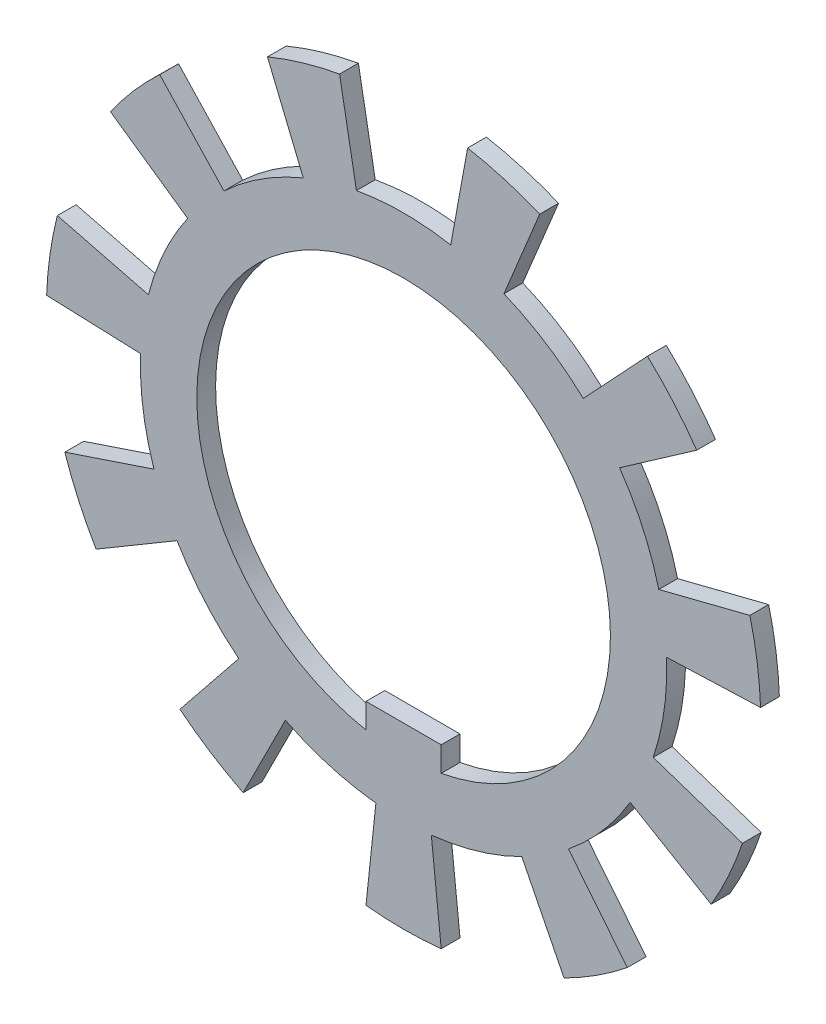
SolidWorks part; units mm, degrees
ref_plane "Front Plane" through (0, 0, 0) normal (0, 0, 1) x (1, 0, 0)
ref_plane "Top Plane" through (0, 0, 0) normal (0, 1, 0) x (1, 0, 0)
ref_plane "Right Plane" through (0, 0, 0) normal (1, 0, 0) x (0, 0, -1)
sketch "BodySke" plane through (0, 0, 0) normal (0, 1, 0) x (1, 0, 0)
  line L0 (0, 0) -> (0, 11) construction
  line L1 (0, 0) -> (4, 0) construction
  line L2 (11, 0) -> (19, 0)
  line L3 (11, 0) -> (11, 1)
  line L4 (11, 1) -> (19, 1)
  line L5 (19, 0) -> (19, 1)
  dimension "Inner_dia" = 22
  dimension "Outer_dia" = 38
  dimension "Thickness" = 1
  dimension "Num_tooth" = 11
  dimension "Tooth_width" = 4
revolve "BaseBody" add sketch "BodySke" angle 360 about L0
sketch "ToothSke" plane through (0, 0, 0) normal (0, 0, 1) x (1, 0, 0)
  line L0 (0, 0) -> (0, 2.7341) construction
  line L2 (-2.5084, 13.7735) -> (-3.4042, 18.6926)
  line L4 (2.5084, 13.7735) -> (3.4042, 18.6926)
  circle A0 centre (0, 0) radius 14 construction
  arc A1 (-2.5084, 13.7735) -> (2.5084, 13.7735) centre (0, 0) cw
  circle A2 centre (0, 0) radius 11 construction
  circle A3 centre (0, 0) radius 11 construction
  circle A4 centre (0, 0) radius 19 construction
  circle A6 centre (0, 0) radius 19 construction
  arc A7 (-3.4042, 18.6926) -> (3.4042, 18.6926) centre (0, 0) cw
  point P11 (0, 1.083)
  point P12 (0, 14)
  point P15 (0, 2.4103)
  point P16 (0, 19)
  dimension "Tooth_bottom_dia" = 28
  dimension "D2" = 20.643
  dimension "D3" = 6.8084
extrude "ToothCut" cut sketch "ToothSke" against normal through all
pattern_circular "ToothPat" count 11 over 360 about axis through (0, 0, 0) along (0, 0, 1) of "ToothCut"
sketch "LockBodySke" plane through (0, 0, 0) normal (0, 0, 1) x (1, 0, 0)
  line L0 (0, 1.083) -> (0, -20.8872) construction
  line L2 (-2, -9.5) -> (2, -9.5)
  line L3 (-2, -9.5) -> (-2, -11.5)
  line L4 (-2, -11.5) -> (2, -11.5)
  line L5 (2, -9.5) -> (2, -11.5)
  circle A2 centre (0, 0) radius 11 construction
  dimension "D1" = 0.5
  dimension "Lock_Width" = 4
  dimension "D2" = 2
  dimension "Lock_Height" = 20.5
extrude "LockBody" add sketch "LockBodySke" against normal up to surface (1 mm away)
equation "\"Num_tooth@ToothPat\" = \"Num_tooth@BodySke\""
equation "\"D2@ToothSke\" = 360 / \"Num_tooth@BodySke\" - 2 *  arcsin( \"Tooth_width@BodySke\" / \"Outer_dia@BodySke\" ) "
equation "\"D3@ToothSke\" = \"Outer_dia@BodySke\" *  sin( \"D2@ToothSke\" / 2 ) "
equation "\"D2@LockBodySke\" = \"Lock_Width@LockBodySke\" / 2"
